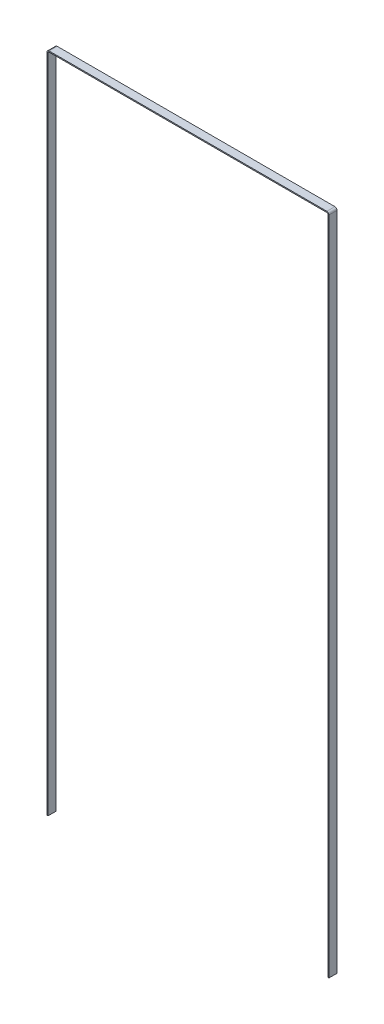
SolidWorks part; units mm, degrees
ref_plane "Plan de face" through (0, 0, 0) normal (0, 0, 1) x (1, 0, 0)
ref_plane "Plan de dessus" through (0, 0, 0) normal (0, 1, 0) x (1, 0, 0)
ref_plane "Plan de droite" through (0, 0, 0) normal (1, 0, 0) x (0, 0, -1)
sketch "Esquisse1" plane through (0, 0, 0) normal (0, 0, 1) x (1, 0, 0)
  line L0 (2, 1228) -> (2, 0)
  line L1 (-518, 1230) -> (-2, 1230)
  line L2 (-520, 1228) -> (-520, 0)
  line L3 (2, 1228) -> (2, -2) construction
  line L4 (0, 1228) -> (0, 0)
  line L6 (-522, 1228) -> (-522, 0)
  line L7 (-518, 1232) -> (-2, 1232)
  line L8 (0, 0) -> (2, 0)
  line L9 (-520, 0) -> (-522, 0)
  line L10 (-522, 1228) -> (-522, -2) construction
  line L12 (-522, -2) -> (2, -2) construction
  line L13 (-520, 0) -> (0, 0) construction
  arc A0 (-2, 1230) -> (0, 1228) centre (-2, 1228) cw
  arc A1 (-518, 1230) -> (-520, 1228) centre (-518, 1228) ccw
  arc A2 (-518, 1232) -> (-522, 1228) centre (-518, 1228) ccw
  arc A3 (-2, 1232) -> (2, 1228) centre (-2, 1228) cw
  point P7 (0, 1230)
  point P10 (-520, 1230)
  dimension "D3" = 2
  dimension "D1" = 520
  dimension "D2" = 1230
  dimension "D4" = 2
extrude "Boss.-Extru.1" add sketch "Esquisse1" along normal blind 15
